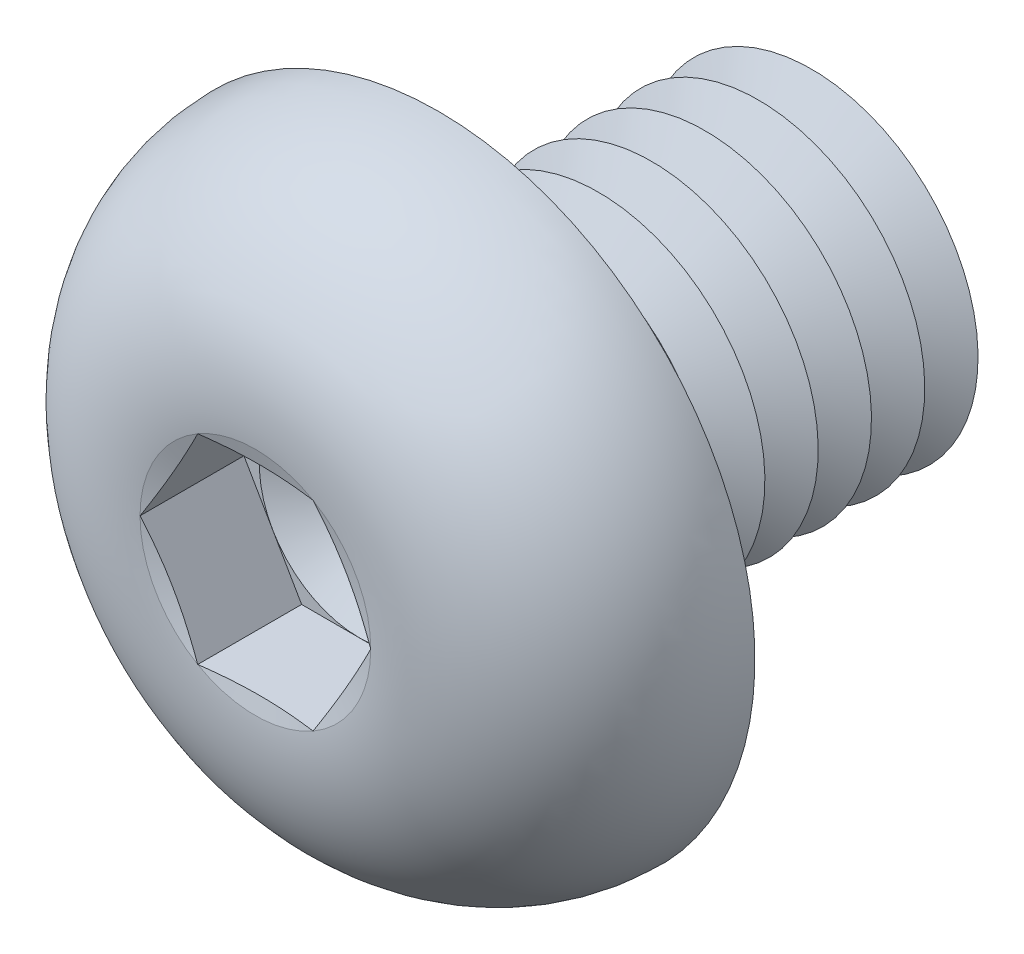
SolidWorks part; units mm, degrees
ref_plane "Front Plane" through (0, 0, 0) normal (0, 0, 1) x (1, 0, 0)
ref_plane "Top Plane" through (0, 0, 0) normal (0, 1, 0) x (1, 0, 0)
ref_plane "Right Plane" through (0, 0, 0) normal (1, 0, 0) x (0, 0, -1)
sketch "Sketch1" plane through (0, 0, 0) normal (1, 0, 0) x (0, 0, -1)
  line L0 (0, 2.5) -> (0, 4.75)
  line L3 (0, 2.5) -> (6, 2.5)
  line L4 (6, 2.5) -> (6, 0)
  line L5 (6, 0) -> (-2.75, 0) construction
  line L6 (-2.75, 0) -> (6, 0)
  line L7 (-2.75, 1.732) -> (-2.75, 0.866) construction
  line L8 (-2.75, 0.866) -> (-2.75, 0)
  line L9 (-2.75, 1.732) -> (-2.5179, 0.866)
  line L10 (-2.5179, 0.866) -> (-2.75, 0.866)
  line L11 (6, 0) -> (22.7481, 0) construction
  line L12 (0, 4.75) -> (-2.75, 4.75) construction
  arc A1 (0, 4.75) -> (-2.75, 1.732) centre (0, 1.9881) ccw
  point P8 (6, 1.25)
  dimension "D1" = 9.5
  dimension "D2" = 5
  dimension "D3" = 2.75
  dimension "D4" = 3.4641
  dimension "D5" = 6
  dimension "D6" = 15
revolve "Revolve1" add sketch "Sketch1" angle 360 about L5
fillet "Fillet1" radius 0.4 1 edges at (0, 2.5, 0)
sketch "Sketch2" plane through (0, 0, 0) normal (1, 0, 0) x (0, 0, -1)
  line L0 (5.6, 2.5) -> (6.4, 2.5)
  line L1 (6, 2.5) -> (0.4, 2.5) construction
  line L2 (6.4, 2.5) -> (6, 1.8072)
  line L3 (6, -2.5) -> (6, 2.5) construction
  line L4 (6, 1.8072) -> (5.6, 2.5)
  dimension "D1" = 0.8
revolve "Cut-Revolve1" cut sketch "Sketch2" angle 360 about axis through (0, 0, -6) along (0, 0, -1)
pattern_linear "LPattern1" count 7 spacing 0.8 along (0, 0, 1) of "Cut-Revolve1"
sketch "Sketch3" plane through (0, 0, 2.75) normal (0, 0, 1) x (1, 0, 0)
  line L7 (0.866, 1.5) -> (-0.866, 1.5)
  line L8 (-0.866, 1.5) -> (-1.7321, 0)
  line L9 (-1.7321, 0) -> (-0.866, -1.5)
  line L10 (-0.866, -1.5) -> (0.866, -1.5)
  line L11 (0.866, -1.5) -> (1.7321, 0)
  line L12 (1.7321, 0) -> (0.866, 1.5)
  circle A0 centre (0, 0) radius 1.5 construction
  circle A3 centre (0, 0) radius 1.7321 construction
extrude "Cut-Extrude1" cut sketch "Sketch3" against normal blind 1.56
sketch "Sketch4" plane through (0, 0, 1.19) normal (0, 0, 1) x (1, 0, 0)
  line L1 (0.866, 1.5) -> (-0.866, 1.5) construction
  circle A0 centre (0, 0) radius 1.5
extrude "Cut-Extrude2" cut sketch "Sketch4" against normal through all draft 60
